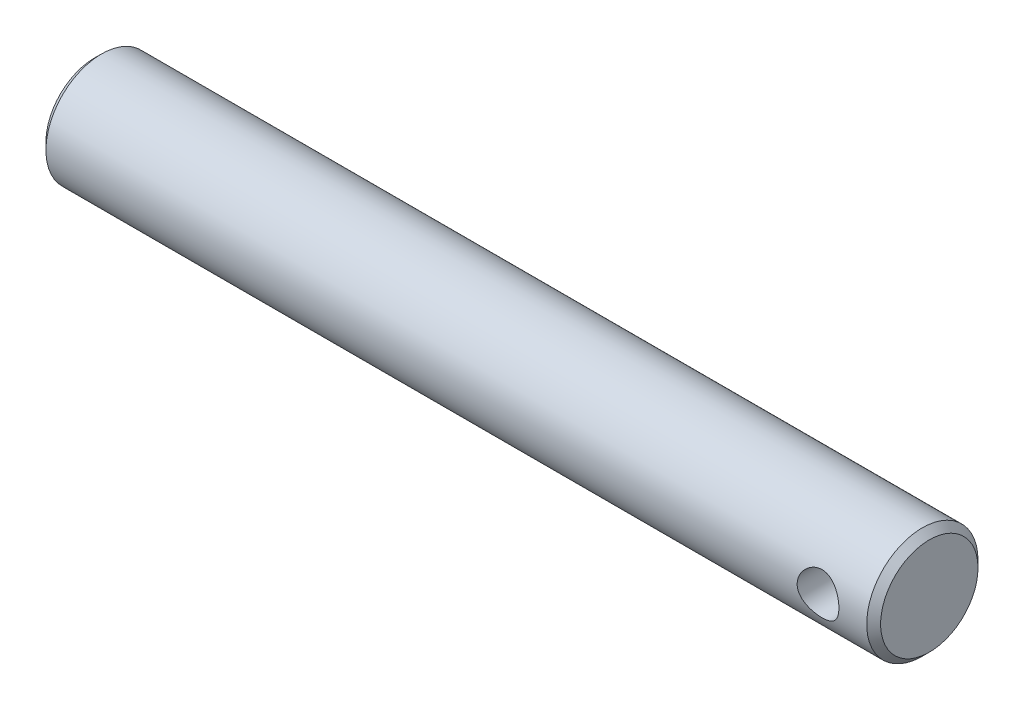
SolidWorks part; units mm, degrees
ref_plane "front" through (0, 0, 0) normal (0, 0, 1) x (1, 0, 0)
ref_plane "top" through (0, 0, 0) normal (0, 1, 0) x (1, 0, 0)
ref_plane "side" through (0, 0, 0) normal (1, 0, 0) x (0, 0, -1)
sketch "Sketch1" plane through (0, 0, 0) normal (1, 0, 0) x (0, 0, -1)
  circle A0 centre (0, 0) radius 6.35
  dimension "D1" = 12.7
extrude "Base-Extrude" add sketch "Sketch1" along normal blind 95.25
sketch "Sketch2" plane through (0, 0, 0) normal (0, 0, 1) x (1, 0, 0)
  line L0 (95.25, 6.35) -> (95.25, -6.35) construction
  line L1 (50, 0) -> (-50, 0) construction
  circle A0 centre (88.9, 0) radius 2.3813
  dimension "D2" = 4.7625
  dimension "D1" = 6.35
extrude "Cut-Extrude1" cut sketch "Sketch2" against normal through all and the other way through all
sketch "Sketch3" plane through (0, 0, 0) normal (-1, 0, 0) x (0, 0, 1)
  circle A0 centre (0, 0) radius 3.556
  dimension "D1" = 7.112
extrude "Cut-Extrude2" cut sketch "Sketch3" against normal blind 31.75
chamfer "Chamfer1" distance 0.7937 angle 45 3 edges at (95.25, 0, -6.35) (0, 0, -6.35) (31.75, 0, 3.556)
